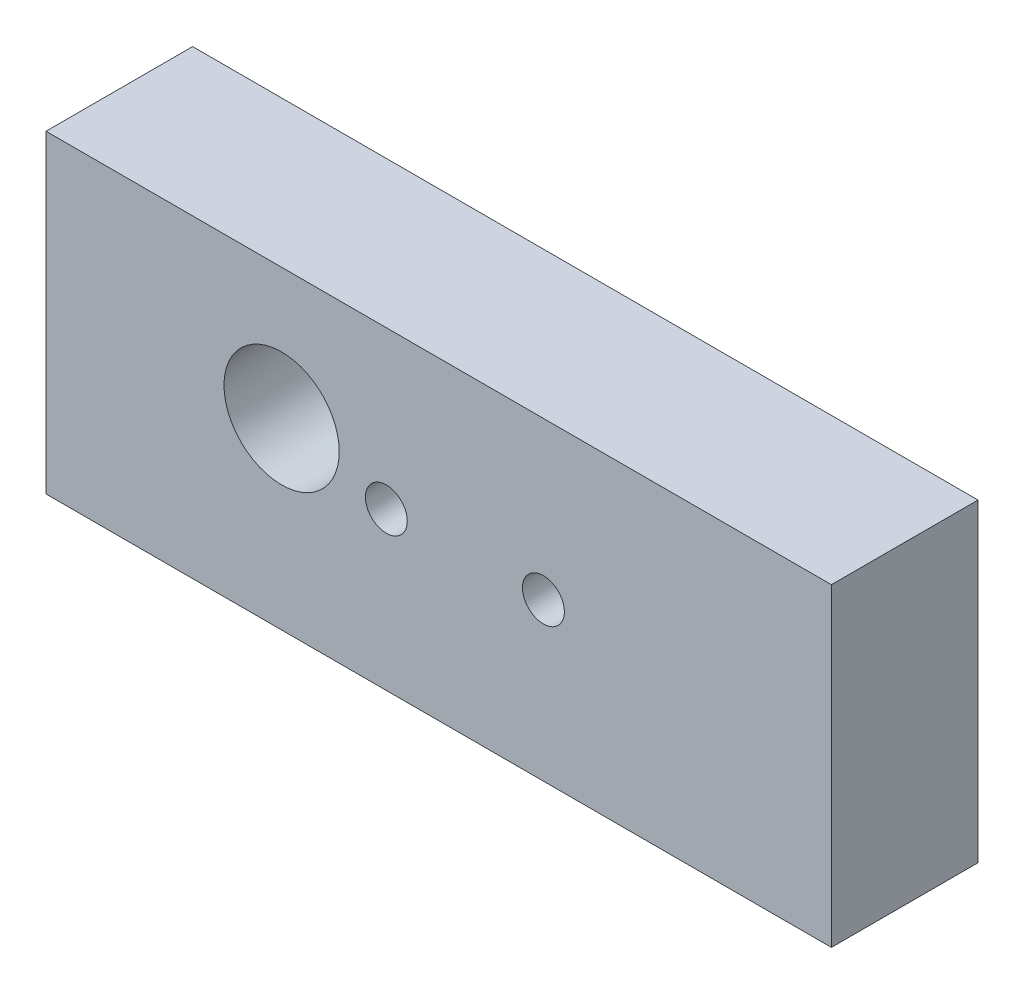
SolidWorks part; units mm, degrees
ref_plane "前视基准面" through (0, 0, 0) normal (0, 0, 1) x (1, 0, 0)
ref_plane "上视基准面" through (0, 0, 0) normal (0, 1, 0) x (1, 0, 0)
ref_plane "右视基准面" through (0, 0, 0) normal (1, 0, 0) x (0, 0, -1)
other "Configuration Table"
sketch "草图1" plane through (0, 0, 0) normal (0, 0, 1) x (1, 0, 0)
  line L1 (0, 0) -> (150, 0)
  line L2 (0, 0) -> (0, 60)
  line L3 (0, 60) -> (150, 60)
  line L4 (150, 0) -> (150, 60)
  dimension "D1" = 150
  dimension "D2" = 60
extrude "凸台-拉伸1" add sketch "草图1" against normal blind 28
sketch "草图2" plane through (0, 0, 0) normal (0, 0, 1) x (1, 0, 0)
  line L0 (0, 0) -> (45, 0) construction
  line L1 (0, 0) -> (150, 0) construction
  line L2 (45, 0) -> (45, 35) construction
  circle A0 centre (45, 35) radius 11
  dimension "D3" = 22
  dimension "D1" = 45
  dimension "D2" = 35
extrude "切除-拉伸1" cut sketch "草图2" against normal blind 20
sketch "草图3" plane through (0, 0, 0) normal (0, 0, 1) x (1, 0, 0)
  line L0 (65, 30) -> (95, 30) construction
  circle A0 centre (65, 30) radius 4
  circle A1 centre (95, 30) radius 4
  dimension "D1" = 30
extrude "切除-拉伸2" cut sketch "草图3" against normal blind 20
